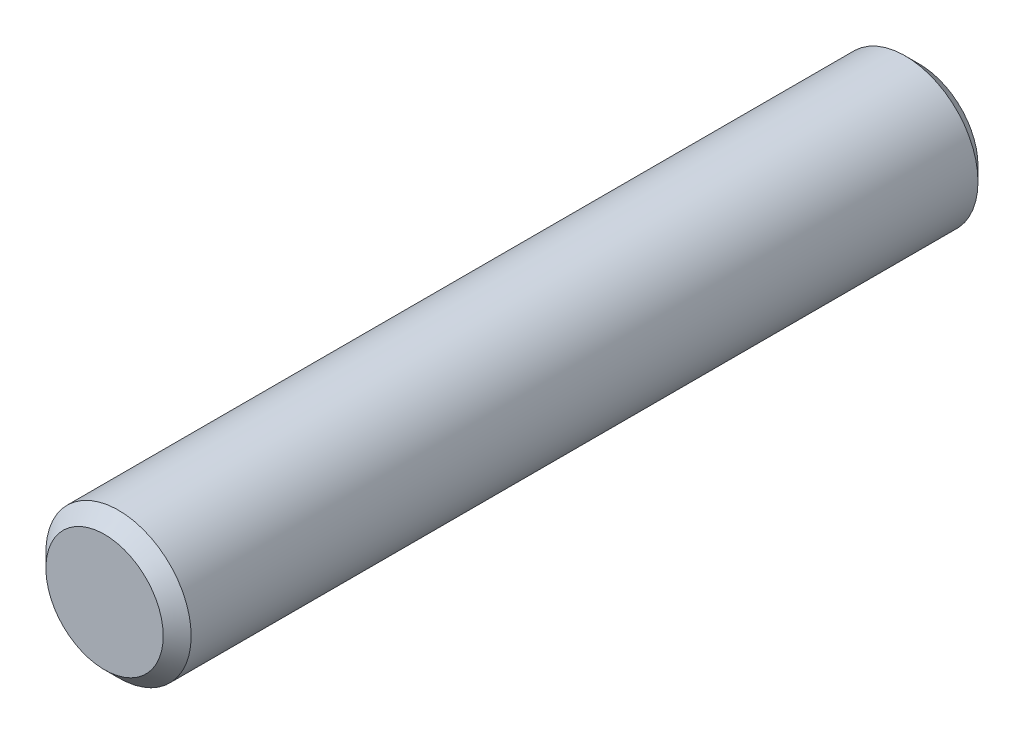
SolidWorks part; units mm, degrees
ref_plane "Front Plane" through (0, 0, 0) normal (0, 0, 1) x (1, 0, 0)
ref_plane "Top Plane" through (0, 0, 0) normal (0, 1, 0) x (1, 0, 0)
ref_plane "Right Plane" through (0, 0, 0) normal (1, 0, 0) x (0, 0, -1)
sketch "Sketch1" plane through (0, 0, 0) normal (0, 0, 1) x (1, 0, 0)
  circle A0 centre (0, 0) radius 1.9812
  dimension "D1" = 3.9624
extrude "Boss-Extrude1" add sketch "Sketch1" along normal mid plane 22.225
chamfer "Chamfer1" distance 0.381 angle 45 2 edges at (1.9812, 0, -11.1125) (1.9812, 0, 11.1125)
